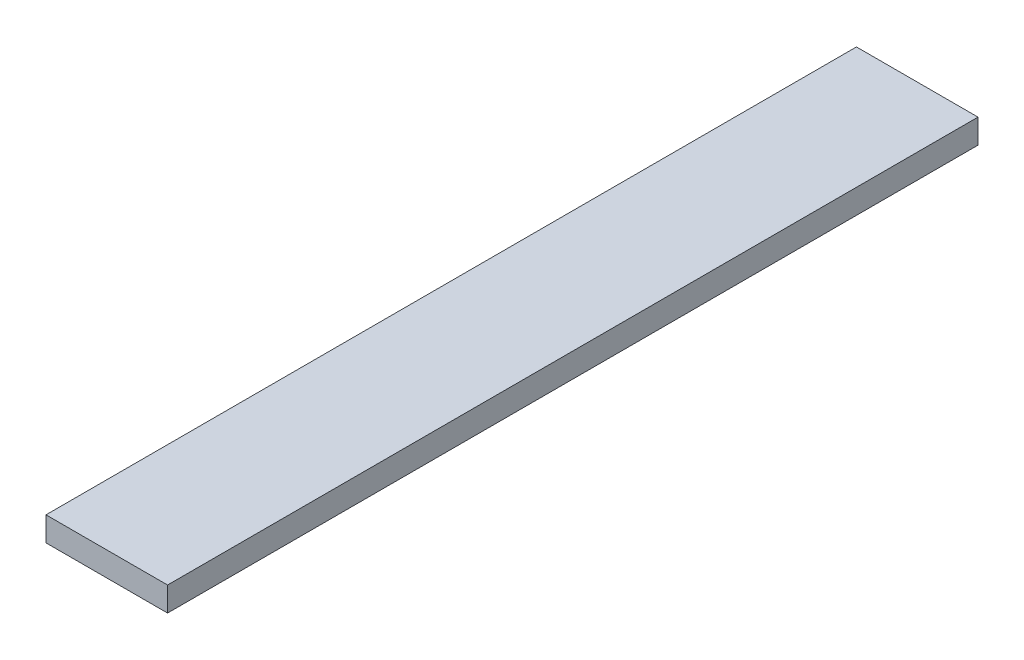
SolidWorks part; units mm, degrees
ref_plane "Front" through (0, 0, 0) normal (0, 0, 1) x (1, 0, 0)
ref_plane "Top" through (0, 0, 0) normal (0, 1, 0) x (1, 0, 0)
ref_plane "Right" through (0, 0, 0) normal (1, 0, 0) x (0, 0, -1)
sketch "Sketch1" plane through (0, 0, 0) normal (0, 1, 0) x (1, 0, 0)
  line L1 (-30, 200) -> (30, 200)
  line L2 (-30, 200) -> (-30, -200)
  line L3 (-30, -200) -> (30, -200)
  line L4 (30, 200) -> (30, -200)
  line L5 (-30, 200) -> (30, -200) construction
  line L6 (-30, -200) -> (30, 200) construction
  point P0 (0, 0)
  dimension "D1" = 400
  dimension "D2" = 60
extrude "Boss-Extrude1" add sketch "Sketch1" along normal blind 12
